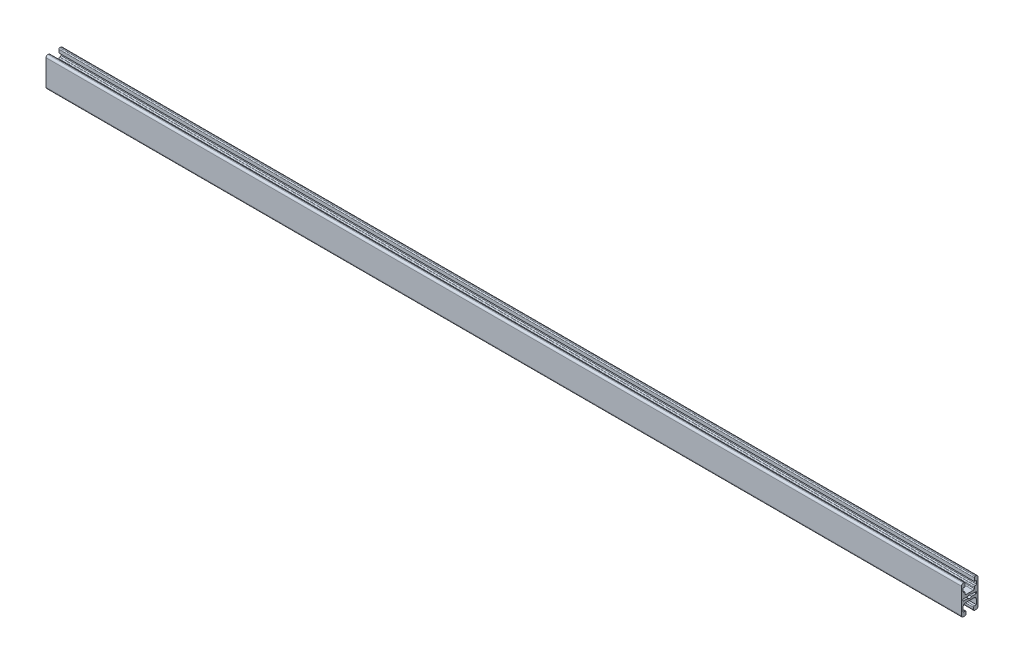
SolidWorks part; units mm, degrees
ref_plane "Ebene vorne" through (0, 0, 0) normal (0, 0, 1) x (1, 0, 0)
ref_plane "Ebene oben" through (0, 0, 0) normal (0, 1, 0) x (1, 0, 0)
ref_plane "Ebene rechts" through (0, 0, 0) normal (1, 0, 0) x (0, 0, -1)
sketch "Skizze1" plane through (0, 0, 0) normal (0, 1, 0) x (1, 0, 0)
  line L0 (0, 0) -> (1000, 0)
  dimension "D1" = 1000
other "Strukturbauteil1"
ref_plane "Ebene1" through (0, 0, 0) normal (1, 0, 0) x (0, 0, -1)
sketch "Model2" plane through (0, 0, 0) normal (1, 0, 0) x (0, 0, -1)
  line L0 (-9, -14) -> (-9, 14)
  line L1 (-7, 16) -> (-6, 16)
  line L2 (-5, 15) -> (-5, 11.5)
  line L3 (-5, 11.5) -> (-7.175, 11.5)
  line L4 (-7.175, 11.5) -> (-7.175, 8)
  line L5 (-6.175, 7) -> (-6, 7)
  line L6 (-5, 6) -> (-5, 4.75)
  line L7 (-4, 3.75) -> (4, 3.75)
  line L8 (5, 4.75) -> (5, 6)
  line L9 (6, 7) -> (6.175, 7)
  line L10 (7.175, 8) -> (7.175, 11.5)
  line L11 (7.175, 11.5) -> (5, 11.5)
  line L12 (5, 11.5) -> (5, 15)
  line L13 (6, 16) -> (7, 16)
  line L14 (9, 14) -> (9, -14)
  line L15 (7, -16) -> (5.5, -16)
  line L16 (4, -14.5) -> (4, -12.5)
  line L17 (5, -11.5) -> (7.175, -11.5)
  line L18 (7.175, -11.5) -> (7.175, -6.25)
  line L19 (4.675, -3.75) -> (-4.675, -3.75)
  line L20 (-7.175, -6.25) -> (-7.175, -11.5)
  line L21 (-7.175, -11.5) -> (-5, -11.5)
  line L22 (-4, -12.5) -> (-4, -14.5)
  line L23 (-5.5, -16) -> (-7, -16)
  line L24 (-1.8466, -1) -> (-7.175, -1)
  line L25 (-7.175, -1) -> (-7.175, 1)
  line L26 (-7.175, 1) -> (-1.8466, 1)
  line L27 (1.8466, 1) -> (7.175, 1)
  line L28 (7.175, 1) -> (7.175, -1)
  line L29 (7.175, -1) -> (1.8466, -1)
  line L30 (0, 0) -> (0, 16) construction
  line L31 (0, 0) -> (0, -16) construction
  line L33 (-9, -16) -> (9, -16) construction
  line L34 (-9, -16) -> (-9, 16) construction
  line L35 (-9, 16) -> (9, 16) construction
  line L36 (9, -16) -> (9, 16) construction
  line L37 (-9, -16) -> (9, 16) construction
  line L38 (-9, 16) -> (9, -16) construction
  arc A0 (-7, 16) -> (-9, 14) centre (-7, 14) ccw
  arc A1 (-5, 15) -> (-6, 16) centre (-6, 15) ccw
  arc A2 (-7.175, 8) -> (-6.175, 7) centre (-6.175, 8) ccw
  arc A3 (-5, 6) -> (-6, 7) centre (-6, 6) ccw
  arc A4 (-5, 4.75) -> (-4, 3.75) centre (-4, 4.75) ccw
  arc A5 (4, 3.75) -> (5, 4.75) centre (4, 4.75) ccw
  arc A6 (6, 7) -> (5, 6) centre (6, 6) ccw
  arc A7 (6.175, 7) -> (7.175, 8) centre (6.175, 8) ccw
  arc A8 (6, 16) -> (5, 15) centre (6, 15) ccw
  arc A9 (9, 14) -> (7, 16) centre (7, 14) ccw
  arc A10 (7, -16) -> (9, -14) centre (7, -14) ccw
  arc A11 (4, -14.5) -> (5.5, -16) centre (5.5, -14.5) ccw
  arc A12 (5, -11.5) -> (4, -12.5) centre (5, -12.5) ccw
  arc A13 (7.175, -6.25) -> (4.675, -3.75) centre (4.675, -6.25) ccw
  arc A14 (-4.675, -3.75) -> (-7.175, -6.25) centre (-4.675, -6.25) ccw
  arc A15 (-4, -12.5) -> (-5, -11.5) centre (-5, -12.5) ccw
  arc A16 (-5.5, -16) -> (-4, -14.5) centre (-5.5, -14.5) ccw
  arc A17 (-9, -14) -> (-7, -16) centre (-7, -14) ccw
  arc A18 (1.8466, 1) -> (-1.8466, 1) centre (0, 0) ccw
  arc A19 (-1.8466, -1) -> (1.8466, -1) centre (0, 0) ccw
  point P25 (0, 0)
  point P75 (0, 0)
  point P76 (-9, 0)
  point P77 (9, 0)
  point P79 (0, -16)
  point P80 (0, 16)
